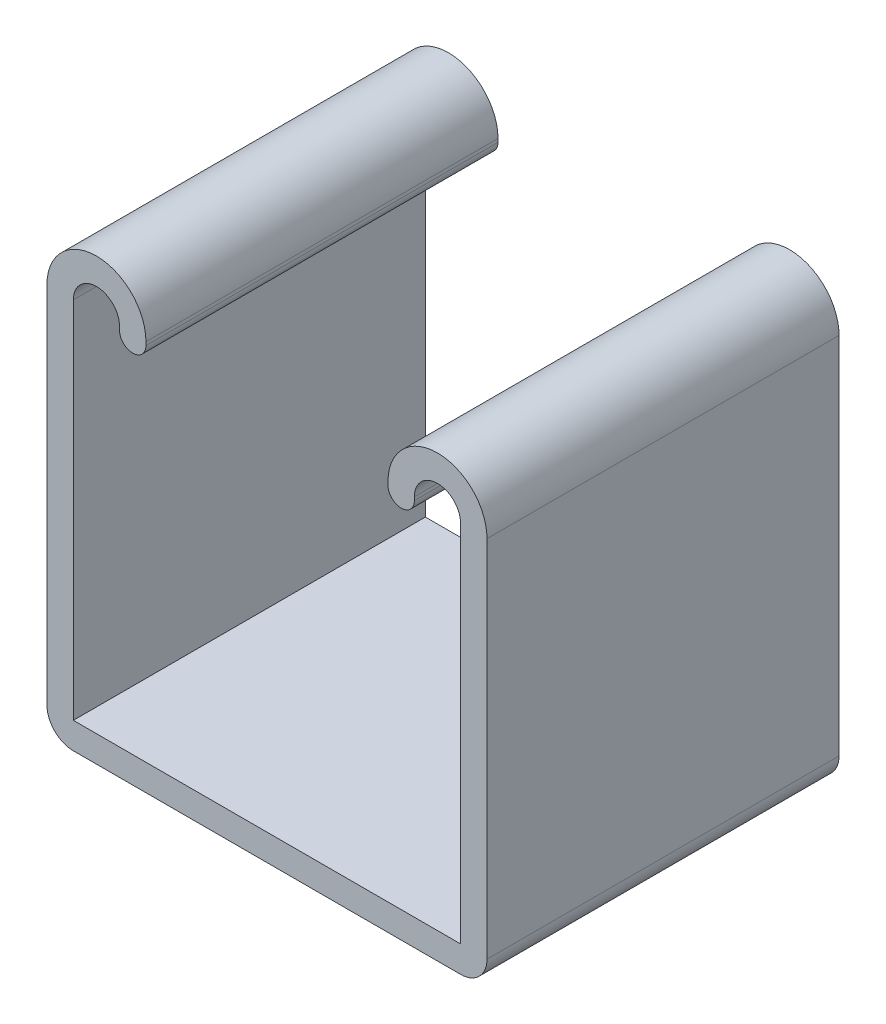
SolidWorks part; units mm, degrees
ref_plane "Plane1" through (0, 0, 0) normal (0, 0, 1) x (1, 0, 0)
ref_plane "Plane2" through (0, 0, 0) normal (0, 1, 0) x (1, 0, 0)
ref_plane "Plane3" through (0, 0, 0) normal (1, 0, 0) x (0, 0, -1)
sketch "Sketch1" plane through (0, 0, 0) normal (0, 0, 1) x (1, 0, 0)
  line L0 (-15.875, 14.3605) -> (-15.875, -11.9126)
  line L1 (-13.97, -13.8176) -> (13.97, -13.8176)
  line L2 (15.875, -11.9126) -> (15.875, 14.3605)
  line L3 (8.7312, 14.3605) -> (8.7312, 14.1224)
  line L4 (-8.7313, 14.3605) -> (-8.7313, 14.1224)
  line L5 (-10.6363, 14.3605) -> (-10.6363, 14.1224)
  line L6 (-13.97, 14.3605) -> (-13.97, -11.9126)
  line L7 (-13.97, -11.9126) -> (13.97, -11.9126)
  line L8 (13.97, -11.9126) -> (13.97, 14.3605)
  line L9 (10.6362, 14.3605) -> (10.6362, 14.1224)
  line L10 (-25.4, 17.9324) -> (25.4, 17.9324) construction
  line L11 (-12.8524, 13.1699) -> (12.8524, 13.1699) construction
  arc A0 (15.875, 14.3605) -> (8.7312, 14.3605) centre (12.3031, 14.3605) ccw
  arc A1 (-15.875, 14.3605) -> (-8.7313, 14.3605) centre (-12.3031, 14.3605) cw
  arc A2 (-13.97, -13.8176) -> (-15.875, -11.9126) centre (-13.97, -11.9126) cw
  arc A3 (13.97, -13.8176) -> (15.875, -11.9126) centre (13.97, -11.9126) ccw
  arc A4 (-13.97, 14.3605) -> (-10.6363, 14.3605) centre (-12.3031, 14.3605) cw
  arc A5 (13.97, 14.3605) -> (10.6362, 14.3605) centre (12.3031, 14.3605) ccw
  arc A6 (8.7312, 14.1224) -> (10.6362, 14.1224) centre (9.6837, 14.1224) ccw
  arc A7 (-8.7313, 14.1224) -> (-10.6363, 14.1224) centre (-9.6838, 14.1224) cw
  dimension "D1" = 1.905
  dimension "D3" = 15.875
  dimension "Width" = 31.75
  dimension "D5" = 13.8176
  dimension "D6" = 7.1437
  dimension "D7" = 17.4625
  dimension "D8" = 17.9324
  dimension "D9" = 4.7625
  dimension "gauge" = 1.905
extrude "Base-Extrude" add sketch "Sketch1" along normal mid plane 25.4
equation "\"D3@Sketch1\" = \"Width@Sketch1\" / 2"
equation "\"D7@Sketch1\" = \"Width@Sketch1\" - 2 * \"D6@Sketch1\""
equation "\"D1@Sketch1\" = \"gauge@Sketch1\""
